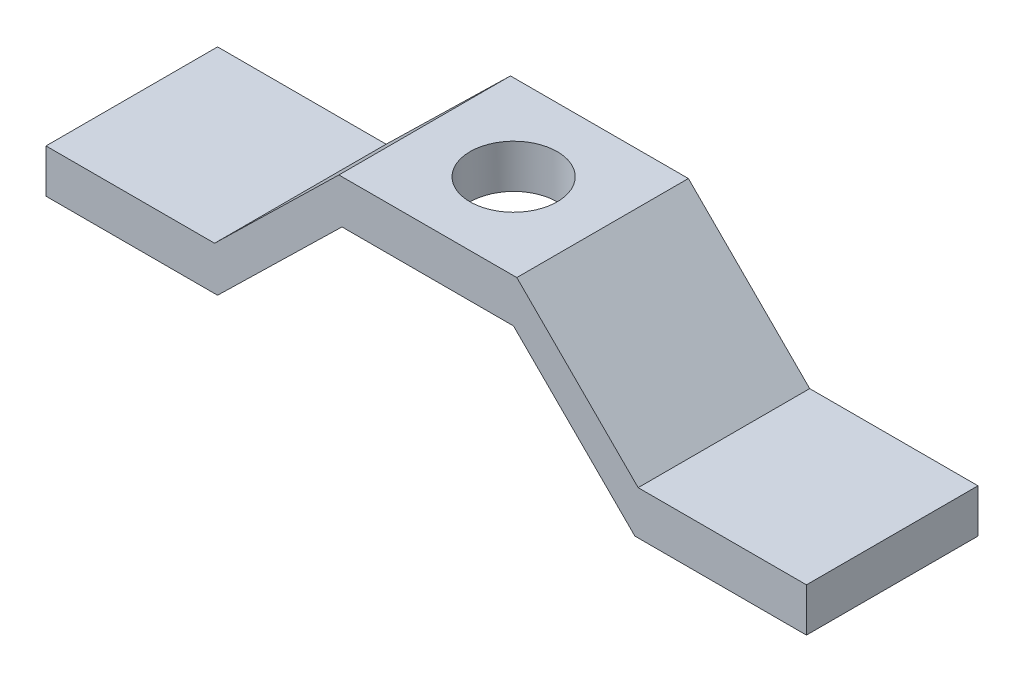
SolidWorks part; units mm, degrees
ref_plane "Front Plane" through (0, 0, 0) normal (0, 0, 1) x (1, 0, 0)
ref_plane "Top Plane" through (0, 0, 0) normal (0, 1, 0) x (1, 0, 0)
ref_plane "Right Plane" through (0, 0, 0) normal (1, 0, 0) x (0, 0, -1)
sketch "Sketch3" plane through (0, 0, 0) normal (0, 0, 1) x (1, 0, 0)
  line L0 (-65.8252, -43.7235) -> (-51.3322, -29.5835)
  line L1 (-85.4765, -48.8035) -> (-65.4765, -48.8035)
  line L2 (-85.4765, -48.8035) -> (-85.4765, -43.7235)
  line L3 (-85.4765, -43.7235) -> (-65.8252, -43.7235)
  line L4 (-51.3322, -29.5835) -> (-30.5892, -29.5706)
  line L5 (-50.9703, -34.6506) -> (-30.9703, -34.6506)
  line L7 (-65.4765, -48.8035) -> (-50.9703, -34.6506)
  line L8 (-30.9703, -34.6506) -> (-16.826, -48.7906)
  line L15 (-30.5892, -29.5706) -> (-16.4449, -43.7106)
  line L17 (-16.826, -48.7906) -> (3.174, -48.7906)
  line L19 (-16.4449, -43.7106) -> (3.174, -43.7106)
  line L20 (3.174, -48.7906) -> (3.174, -43.7106)
extrude "Boss-Extrude2" add sketch "Sketch3" along normal blind 20 contours L5 L8 L17 L20 L19 L15 L4 L0 L3 L2 L1 L7
sketch "Sketch4" plane through (0.0184, -29.5516, 0) normal (-0.0006, 1, 0) x (1, 0.0006, 0)
  line L0 (-51.3506, 0) -> (-30.6076, -20) construction
  line L1 (-51.3506, -20) -> (-30.6076, 0) construction
  circle A0 centre (-40.9791, -10) radius 5.08
extrude "Cut-Extrude1" cut sketch "Sketch4" against normal blind 5.08
